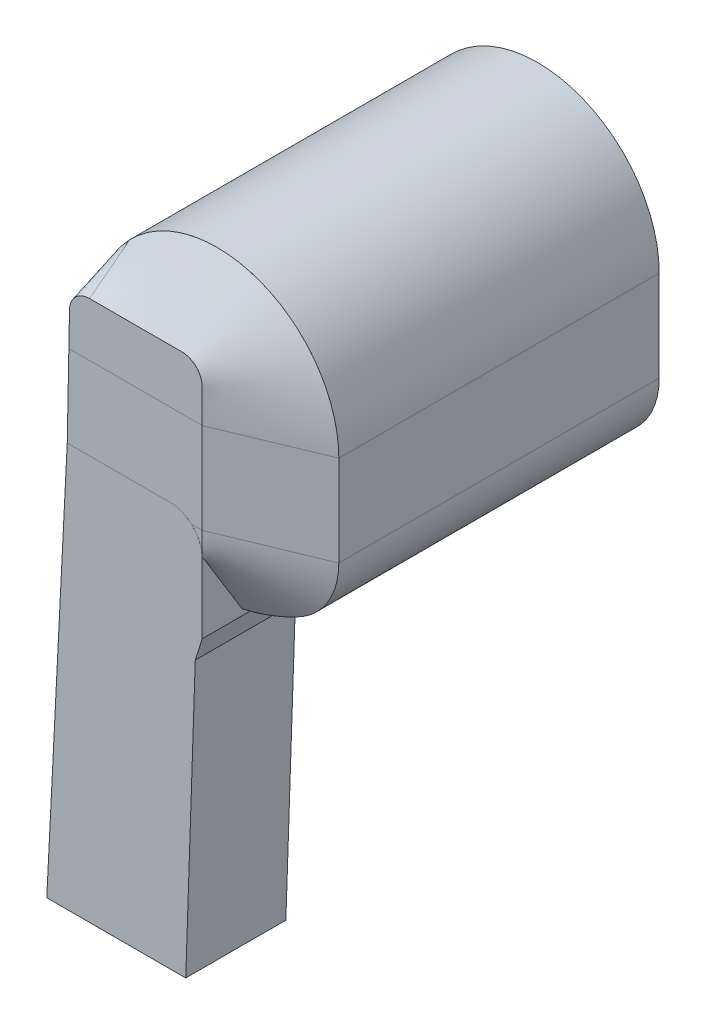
SolidWorks part; units mm, degrees
ref_plane "Ebene vorne" through (0, 0, 0) normal (0, 0, 1) x (1, 0, 0)
ref_plane "Ebene oben" through (0, 0, 0) normal (0, 1, 0) x (1, 0, 0)
ref_plane "Ebene rechts" through (0, 0, 0) normal (1, 0, 0) x (0, 0, -1)
sketch "Skizze3" plane through (0, 0, 0) normal (0, 0, 1) x (1, 0, 0)
  line L0 (-12.748, -52.9148) -> (-14.6943, -50.4877)
  line L1 (-14.6943, -50.4877) -> (-17.929, -50.4877)
  line L2 (-19.5552, -48.8102) -> (-17.5102, 17.0395)
  line L3 (-17.5102, 17.0395) -> (-16.3186, 17.0395)
  line L4 (-14.5075, 19.2478) -> (-13.9759, 46.7281)
  line L5 (-8.7711, 53.4222) -> (12.5993, 53.4222)
  line L6 (19.5494, 44.9018) -> (19.5494, 27.9209)
  line L7 (19.5494, 27.9209) -> (17.8303, 22.4647)
  line L8 (17.8303, 22.4647) -> (15.3711, -49.8358)
  line L9 (15.3711, -49.8358) -> (12.0099, -53.4594)
  line L10 (12.0099, -53.4594) -> (-12.748, -52.9148)
  circle A0 centre (0.1472, -2.0361) radius 3.5144
  arc A1 (-19.5552, -48.8102) -> (-17.929, -50.4877) centre (-17.929, -48.8607) ccw
  arc A2 (-16.3186, 17.0395) -> (-14.5075, 19.2478) centre (-16.8776, 19.3447) ccw
  arc A3 (-8.7711, 53.4222) -> (-13.9759, 46.7281) centre (-7.2405, 46.8617) ccw
  arc A4 (19.5494, 44.9018) -> (12.5993, 53.4222) centre (11.3313, 45.2932) ccw
sketch "Skizze4" plane through (0, 0, 0) normal (0, 0, 1) x (1, 0, 0)
  line L0 (-12.1967, 51.4246) -> (-13.1539, 51.4246)
  line L2 (-13.4766, 87.4439) -> (-14.1538, 52.4439)
  line L3 (19.5494, 44.9018) -> (19.5494, 27.9209) construction
  line L4 (43.6726, 51.3768) -> (43.6726, 74.0471)
  line L5 (-8.7711, 53.4222) -> (12.5993, 53.4222) construction
  line L8 (-8.7711, 53.4222) -> (12.5993, 53.4222)
  line L9 (19.5494, 44.9018) -> (19.5494, 29.4097)
  line L14 (-14.5075, 19.2478) -> (-13.9759, 46.7281) construction
  arc A0 (43.6726, 51.3768) -> (34.0095, 34.9386) centre (24.8592, 51.3768) cw
  arc A1 (43.6726, 74.0471) -> (-12.9301, 89.3862) centre (13.2929, 74.0471) ccw
  arc A2 (-12.9301, 89.3862) -> (-13.4766, 87.4439) centre (-9.4774, 87.3665) ccw
  arc A3 (-8.7711, 53.4222) -> (-13.9759, 46.7281) centre (-7.2405, 46.8617) ccw construction
  arc A4 (19.5494, 44.9018) -> (12.5993, 53.4222) centre (11.3313, 45.2932) ccw construction
  arc A5 (-8.7711, 53.4222) -> (-12.1967, 51.4246) centre (-7.2405, 46.8617) ccw
  arc A6 (19.5494, 44.9018) -> (12.5993, 53.4222) centre (11.3313, 45.2932) ccw
  arc A7 (34.0095, 34.9386) -> (19.5494, 29.4097) centre (7.5426, 82.4858) cw
  arc A8 (-14.1538, 52.4439) -> (-13.1539, 51.4246) centre (-13.1539, 52.4246) ccw
  point P13 (19.5494, 29.4097)
  point P14 (34.0095, 34.9386)
  dimension "D3" = 4
  dimension "D1" = 1
  dimension "D2" = 35
extrude "Linear austragen2" add sketch "Skizze4" against normal blind 65
sketch "Skizze8" plane through (0, 0, 0) normal (0, 0, 1) x (1, 0, 0)
  line L4 (-10.7531, 73.1244) -> (-10.9544, 62.7185)
  line L5 (-13.4766, 87.4439) -> (-14.1538, 52.4439) construction
  line L6 (-5.9641, 57.6218) -> (17.8078, 57.5801)
  arc A2 (-10.9544, 62.7185) -> (-5.9641, 57.6218) centre (-5.9554, 62.6218) ccw
  arc A3 (-10.7531, 73.1244) -> (-7.2516, 83.8309) centre (8.5054, 72.7518) cw
  arc A4 (43.6726, 74.0471) -> (-12.9301, 89.3862) centre (13.2929, 74.0471) ccw construction
  spline S0 degree 3 poles (-7.2516, 83.8309) (-6.6435, 85.7397) (-4.8338, 91.4199) (3.4739, 97.2386) (14.6974, 99.2738) (26.3685, 96.7743) (34.7702, 88.3663) (39.8457, 77.5371) (41.4737, 66.841) (40.9265, 59.6668) (40.7202, 56.961) knots 0.004715 0.004715 0.004715 0.004715 0.075335 0.214866 0.335973 0.47969 0.620641 0.743145 0.903126 1 1 1 1
  spline S1 degree 3 poles (17.8078, 57.5801) (18.2229, 57.4656) (19.3265, 57.1613) (20.2855, 56.5276) (20.8837, 56.1323) knots 0 0 0 0 0.37617 1 1 1 1
  spline S2 degree 3 poles (20.8837, 56.1323) (21.873, 54.7662) (24.1309, 51.6486) (23.2771, 45.0712) (30.5484, 40.5491) (34.0974, 43.6633) (35.7706, 45.1315) knots 0 0 0 0 0.203298 0.463965 0.74728 1 1 1 1
  spline S3 degree 3 poles (40.7202, 56.961) (40.1667, 54.9844) (39.0058, 50.8388) (36.8819, 47.0919) (35.7706, 45.1315) knots 0 0 0 0 0.476815 1 1 1 1
  point P11 (-11.5897, 91.4766)
  point P12 (-4.3987, 98.744)
  point P16 (12.0638, 104.402)
  point P17 (29.1231, 99.9765)
  point P18 (42.0464, 83.8535)
  point P19 (43.5921, 71.8367)
  point P20 (41.8776, 63.7593)
  point P21 (39.6822, 58.9961)
  point P22 (-5.0364, 89.3327)
  point P23 (4.1359, 96.6261)
  point P24 (14.1255, 98.5401)
  point P25 (25.8583, 95.7059)
  point P26 (34.4987, 87.614)
  point P27 (38.9877, 78.3563)
  point P28 (41.1046, 65.088)
  point P29 (40.7202, 56.961)
  point P35 (38.8407, 51.1216)
  point P39 (35.7706, 45.1315)
  point P41 (30.4524, 42.0953)
  point P43 (24.5857, 45.661)
  point P45 (23.3164, 51.8486)
  point P46 (20.8837, 56.1323)
  point P47 (19.0327, 57.19)
  dimension "D3" = 5
  dimension "D1" = 3
extrude "Schnitt-Linear austragen2" cut sketch "Skizze8" against normal blind 62
sketch "Skizze12" plane through (0.1012, 57.6112, 0) normal (0.0018, 1, 0) x (1, -0.0018, 0)
  line L0 (-6.0653, 62) -> (17.7066, 62) construction
  line L1 (13.0653, 62) -> (-5.2444, 62)
  line L2 (13.0653, 62) -> (13.0653, 35)
  line L3 (13.0653, 35) -> (-5.2444, 35)
  line L4 (-5.2444, 62) -> (-5.2444, 35)
  line L5 (-6.0653, 0) -> (17.7066, 0) construction
  dimension "D1" = 35
extrude "Schnitt-Linear austragen3" cut sketch "Skizze12" against normal up to next
sketch "Skizze14" plane through (0, 0, 0) normal (0, 0, 1) x (1, 0, 0)
  line L0 (43.6726, 51.3768) -> (43.6726, 74.0471) construction
  line L1 (-13.4766, 87.4439) -> (-14.1538, 52.4439) construction
  line L2 (-13.1539, 51.4246) -> (-12.1967, 51.4246) construction
  line L3 (43.6726, 51.3768) -> (43.6726, 74.0471)
  line L4 (-13.4766, 87.4439) -> (-14.1538, 52.4439)
  line L5 (-13.1539, 51.4246) -> (-12.1967, 51.4246)
  line L6 (19.5494, 44.9018) -> (19.5494, 27.9209) construction
  line L7 (-8.7711, 53.4222) -> (12.5993, 53.4222) construction
  line L8 (19.5494, 44.9018) -> (19.5494, 29.4097)
  line L9 (-8.7711, 53.4222) -> (12.5993, 53.4222)
  line L10 (-5.9641, 57.6218) -> (17.8078, 57.5801) construction
  line L11 (-10.7531, 73.1244) -> (-10.9544, 62.7185) construction
  line L12 (-5.9641, 57.6218) -> (17.8078, 57.5801)
  line L13 (-10.7531, 73.1244) -> (-10.9544, 62.7185)
  arc A0 (19.5494, 29.4097) -> (34.0095, 34.9386) centre (7.5426, 82.4858) ccw construction
  arc A1 (34.0095, 34.9386) -> (43.6726, 51.3768) centre (24.8592, 51.3768) ccw construction
  arc A2 (43.6726, 74.0471) -> (-12.9301, 89.3862) centre (13.2929, 74.0471) ccw construction
  arc A3 (-12.9301, 89.3862) -> (-13.4766, 87.4439) centre (-9.4774, 87.3665) ccw construction
  arc A4 (-14.1538, 52.4439) -> (-13.1539, 51.4246) centre (-13.1539, 52.4246) ccw construction
  arc A5 (19.5494, 29.4097) -> (34.0095, 34.9386) centre (7.5426, 82.4858) ccw
  arc A6 (34.0095, 34.9386) -> (43.6726, 51.3768) centre (24.8592, 51.3768) ccw
  arc A7 (43.6726, 74.0471) -> (-12.9301, 89.3862) centre (13.2929, 74.0471) ccw
  arc A8 (-12.9301, 89.3862) -> (-13.4766, 87.4439) centre (-9.4774, 87.3665) ccw
  arc A9 (-14.1538, 52.4439) -> (-13.1539, 51.4246) centre (-13.1539, 52.4246) ccw
  arc A10 (19.5494, 44.9018) -> (12.5993, 53.4222) centre (11.3313, 45.2932) ccw construction
  arc A11 (-8.7711, 53.4222) -> (-13.9759, 46.7281) centre (-7.2405, 46.8617) ccw construction
  arc A12 (19.5494, 44.9018) -> (12.5993, 53.4222) centre (11.3313, 45.2932) ccw
  arc A13 (-8.7711, 53.4222) -> (-12.1967, 51.4246) centre (-7.2405, 46.8617) ccw
  arc A14 (-7.2516, 83.8309) -> (-10.7531, 73.1244) centre (8.5054, 72.7518) ccw construction
  arc A15 (-10.9544, 62.7185) -> (-5.9641, 57.6218) centre (-5.9554, 62.6218) ccw construction
  arc A16 (-7.2516, 83.8309) -> (-10.7531, 73.1244) centre (8.5054, 72.7518) ccw
  arc A17 (-10.9544, 62.7185) -> (-5.9641, 57.6218) centre (-5.9554, 62.6218) ccw
  spline S0 degree 3 poles (1025.7421, -115.4157) (-27.2261, -25.3968) (48.2028, 22.6285) (39.8457, 77.5371) (34.7702, 88.3663) (26.3685, 96.7743) (14.6974, 99.2738) (3.4739, 97.2386) (-28.0379, 75.1679) (44.505, -2.829) (-910.0481, 513.8951) knots -1.563367 -1.563367 -1.563367 -1.563367 0.101589 0.261571 0.384074 0.525026 0.668743 0.78985 0.929381 1.925227 1.925227 1.925227 1.925227 only from (40.7202, 56.961) to (-7.2516, 83.8309) construction
  spline S1 degree 3 poles (915.8138, -429.7609) (-58.0867, 12.6954) (105.4163, 22.2179) (0.6552, 142.7976) (998.0128, -232.1593) knots -7.966825 -7.966825 -7.966825 -7.966825 0.523185 8.723009 8.723009 8.723009 8.723009 only from (35.7706, 45.1315) to (40.7202, 56.961) construction
  spline S2 degree 3 poles (944.8575, 438.5834) (-81.1842, 60.5817) (26.953, 73.3892) (23.2771, 45.0712) (51.3521, 27.6109) (39.9912, 181.48) (300.1258, -919.2923) knots -2.470029 -2.470029 -2.470029 -2.470029 0.203298 0.463965 0.74728 3.279414 3.279414 3.279414 3.279414 only from (20.8837, 56.1323) to (35.7706, 45.1315) construction
  spline S3 degree 3 poles (387.9335, 986.5601) (-19.1556, 29.6191) (40.5609, 100.2465) (22.4179, -6.4684) (460.009, 954.5574) knots -10.165412 -10.165412 -10.165412 -10.165412 0.37617 13.039429 13.039429 13.039429 13.039429 only from (17.8078, 57.5801) to (20.8837, 56.1323) construction
  spline S4 degree 3 poles (40.7202, 56.961) (40.9265, 59.6668) (41.4737, 66.841) (39.8457, 77.5371) (34.7702, 88.3663) (26.3685, 96.7743) (14.6974, 99.2738) (3.4739, 97.2386) (-4.8338, 91.4199) (-6.6435, 85.7397) (-7.2516, 83.8309) knots 0.004715 0.004715 0.004715 0.004715 0.101589 0.261571 0.384074 0.525026 0.668743 0.78985 0.929381 1 1 1 1
  spline S5 degree 3 poles (35.7706, 45.1315) (36.8819, 47.0919) (39.0058, 50.8388) (40.1667, 54.9844) (40.7202, 56.961) knots 0 0 0 0 0.523185 1 1 1 1
  spline S6 degree 3 poles (20.8837, 56.1323) (21.873, 54.7662) (24.1309, 51.6486) (23.2771, 45.0712) (30.5484, 40.5491) (34.0974, 43.6633) (35.7706, 45.1315) knots 0 0 0 0 0.203298 0.463965 0.74728 1 1 1 1
  spline S7 degree 3 poles (17.8078, 57.5801) (18.2229, 57.4656) (19.3265, 57.1613) (20.2855, 56.5276) (20.8837, 56.1323) knots 0 0 0 0 0.37617 1 1 1 1
sketch "Skizze13" plane through (0, 0, 0) normal (0, 0, 1) x (1, 0, 0)
  line L0 (-13.4766, 87.4439) -> (-14.1538, 52.4439) construction
  line L1 (-19.2498, -47.464) -> (15.4518, -47.464)
  line L2 (17.8303, 22.4647) -> (15.3711, -49.8358) construction
  line L3 (15.4518, -47.464) -> (17.8303, 22.4647)
  line L4 (19.5494, 44.9018) -> (19.5494, 27.9209) construction
  line L5 (19.5494, 27.9209) -> (17.8303, 22.4647) construction
  line L6 (19.5494, 44.9018) -> (19.5494, 27.9209)
  line L7 (19.5494, 27.9209) -> (17.8303, 22.4647)
  line L9 (-14.1348, 53.4222) -> (-19.2498, -47.464)
  line L10 (-8.7711, 53.4222) -> (12.5993, 53.4222) construction
  line L11 (-14.1348, 53.4222) -> (12.5993, 53.4222)
  arc A0 (19.5494, 44.9018) -> (12.5993, 53.4222) centre (11.3313, 45.2932) ccw construction
  arc A1 (19.5494, 44.9018) -> (12.5993, 53.4222) centre (11.3313, 45.2932) ccw
extrude "Linear austragen7" add sketch "Skizze13" along normal blind 25 separate body
extrude "Linear austragen8" add sketch "Skizze14" along normal blind 15
sketch "Skizze15" plane through (0, 0, 15) normal (0, 0, 1) x (1, 0, 0)
  line L0 (19.5494, 44.9018) -> (19.5494, 29.4097) construction
  line L1 (-14.1348, 53.4222) -> (12.5993, 53.4222) construction
  line L2 (-13.4766, 87.4439) -> (-14.1348, 53.4222) construction
  line L3 (43.6726, 51.3768) -> (43.6726, 74.0471) construction
  line L4 (19.5494, 44.9018) -> (19.5494, 29.4097)
  line L5 (-14.1348, 53.4222) -> (12.5993, 53.4222)
  line L6 (-13.4766, 87.4439) -> (-14.1348, 53.4222)
  line L7 (43.6726, 51.3768) -> (43.6726, 74.0471)
  arc A0 (19.5494, 44.9018) -> (12.5993, 53.4222) centre (11.3313, 45.2932) ccw construction
  arc A1 (-12.9301, 89.3862) -> (-13.4766, 87.4439) centre (-9.4774, 87.3665) ccw construction
  arc A2 (43.6726, 74.0471) -> (-12.9301, 89.3862) centre (13.2929, 74.0471) ccw construction
  arc A3 (34.0095, 34.9386) -> (43.6726, 51.3768) centre (24.8592, 51.3768) ccw construction
  arc A4 (19.5494, 29.4097) -> (34.0095, 34.9386) centre (7.5426, 82.4858) ccw construction
  arc A5 (19.5494, 44.9018) -> (12.5993, 53.4222) centre (11.3313, 45.2932) ccw
  arc A6 (-12.9301, 89.3862) -> (-13.4766, 87.4439) centre (-9.4774, 87.3665) ccw
  arc A7 (43.6726, 74.0471) -> (-12.9301, 89.3862) centre (13.2929, 74.0471) ccw
  arc A8 (34.0095, 34.9386) -> (43.6726, 51.3768) centre (24.8592, 51.3768) ccw
  arc A9 (19.5494, 29.4097) -> (34.0095, 34.9386) centre (7.5426, 82.4858) ccw
sketch "Skizze16" plane through (0, 0, 25) normal (0, 0, 1) x (1, 0, 0)
  line L0 (12.5993, 53.4222) -> (-14.1348, 53.4222) construction
  line L2 (12.5993, 53.4222) -> (-14.1348, 53.4222)
  line L3 (-14.1348, 53.4222) -> (-13.5715, 82.5406)
  line L5 (-8.5724, 87.4439) -> (14.5494, 87.4439)
  line L6 (19.5494, 82.4439) -> (19.5494, 45.6845)
  arc A0 (19.5494, 44.9018) -> (12.5993, 53.4222) centre (11.3313, 45.2932) ccw construction
  arc A1 (19.5494, 45.6845) -> (12.5993, 53.4222) centre (11.3313, 45.2932) ccw
  arc A2 (-8.5724, 87.4439) -> (-13.5715, 82.5406) centre (-8.5724, 82.4439) ccw
  arc A3 (19.5494, 82.4439) -> (14.5494, 87.4439) centre (14.5494, 82.4439) ccw
  point P6 (-13.4766, 87.4439)
  dimension "D1" = 5
sketch3d "3D-Skizze3"
  line L0 (19.5494, 66.4477, 25) -> (43.6726, 69.7695, 15)
  line L1 (19.5494, 82.4439, 25) -> (19.5494, 45.6845, 25) construction
  line L2 (43.6726, 51.3768, 15) -> (43.6726, 74.0471, 15) construction
  line L3 (19.5494, 79.1783, 25) -> (39.7856, 88.9152, 15)
  line L4 (10.1704, 87.4439, 25) -> (25.2939, 101.956, 15)
  line L5 (-8.5724, 87.4439, 25) -> (14.5494, 87.4439, 25) construction
  line L6 (2.9885, 87.4439, 25) -> (11.656, 104.3827, 15)
  line L7 (19.5494, 55.0435, 25) -> (43.6726, 58.6608, 15)
  line L8 (19.5494, 48.3098, 25) -> (39.2618, 39.2727, 15)
  line L9 (19.5494, 45.6845, 25) -> (19.5494, 29.4097, 15)
  arc A0 (43.6726, 74.0471, 15) -> (-12.9301, 89.3862, 15) centre (13.2929, 74.0471, 15) ccw construction
  arc A1 (34.0095, 34.9386, 15) -> (43.6726, 51.3768, 15) centre (24.8592, 51.3768, 15) ccw construction
  point P11 (13.2929, 74.0471, 45.3797)
  point P25 (24.8592, 51.3768, 33.8133)
surface "Oberfläche-Ebene1" sketch "Skizze16"
sketch "Skizze18" plane through (0, 53.4222, 0) normal (0, 1, 0) x (1, 0, 0)
  line L0 (14.5494, -25) -> (-8.5724, -25) construction
  line L1 (14.5494, -25) -> (-8.5724, -25)
  line L2 (-8.5724, -25) -> (-8.5724, 71.3987)
surface "Oberfläche-Ausformung3"
sketch "Skizze17" plane through (43.6726, 0, 0) normal (1, 0, 0) x (0, 0, -1)
  line L1 (65, 74.0471) -> (-82.7493, 74.0471)
  line L2 (65, 51.3768) -> (-15, 51.3768) construction
  line L3 (65, 51.3768) -> (-63.3195, 51.3768)
  line L5 (65, 74.0471) -> (-15, 74.0471) construction
  line L6 (-63.3195, 51.3768) -> (-82.7493, 74.0471)
surface "Oberfläche-Ausformung4"
surface "Oberfläche-Ausformung5"
surface "Oberfläche-Ausformung6"
